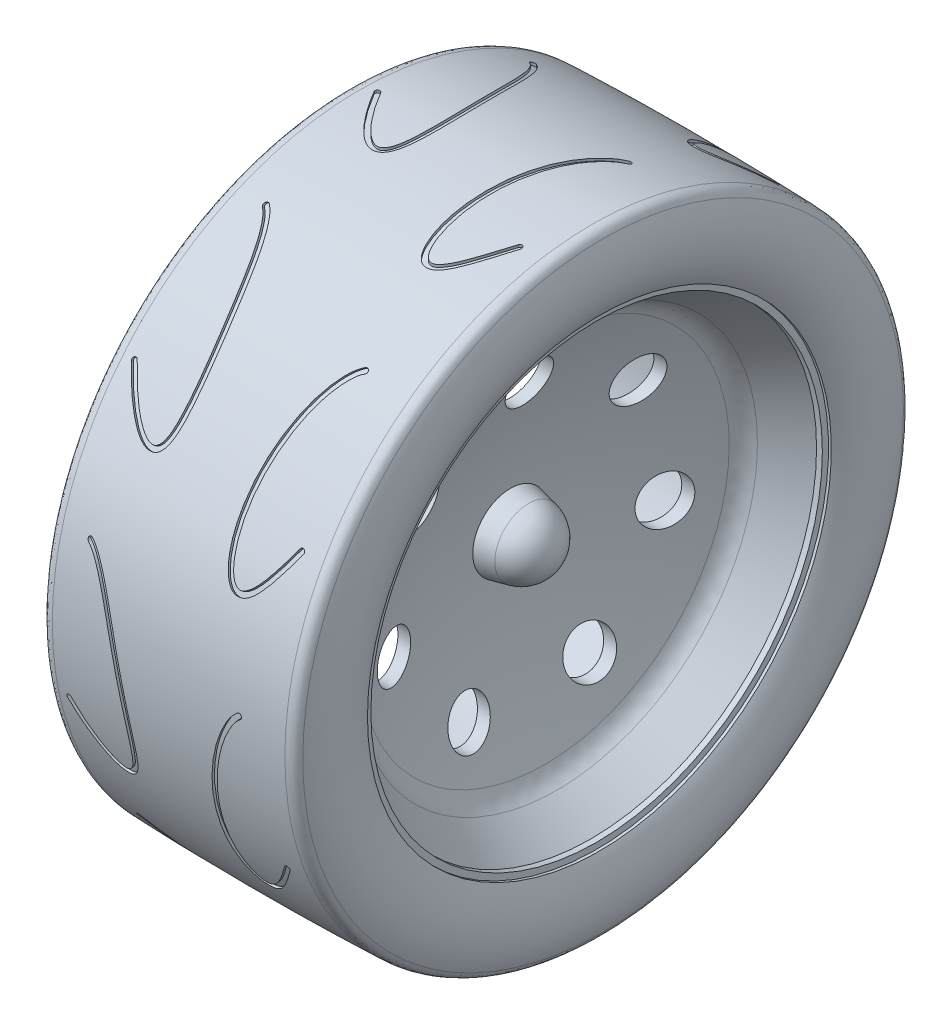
SolidWorks part; units mm, degrees
ref_plane "Front" through (0, 0, 0) normal (0, 0, 1) x (1, 0, 0)
ref_plane "Top" through (0, 0, 0) normal (0, 1, 0) x (1, 0, 0)
ref_plane "Right" through (0, 0, 0) normal (1, 0, 0) x (0, 0, -1)
sketch "Sketch3" plane through (0, 0, 0) normal (0, 0, 1) x (1, 0, 0)
  line L0 (0, 9.934) -> (0, -14.1805) construction
  line L1 (0, 0) -> (3.4314, 0) construction
  line L3 (-2.5342, 4.7625) -> (2.5342, 4.7625)
  arc A0 (-2.5342, 6.3078) -> (2.5342, 6.3078) centre (0, -69.85) cw
  arc A1 (-2.5342, 6.3078) -> (-2.5342, 4.7625) centre (-1.2627, 5.5352) ccw
  arc A2 (2.5342, 6.3078) -> (2.5342, 4.7625) centre (1.2627, 5.5352) cw
  dimension "D1" = 12.7
  dimension "D2" = 76.2
  dimension "D3" = 5.0685
  dimension "D4" = 9.525
revolve "Revolve1" add sketch "Sketch3" angle 360 about L1
sketch "Sketch4" plane through (0, 0, 0) normal (0, 0, 1) x (1, 0, 0)
  line L0 (-4.3412, 0) -> (5.4145, 0) construction
  line L1 (-2.4765, 4.7625) -> (2.4765, 4.7625)
  line L2 (2.5342, 4.7625) -> (-2.5342, 4.7625) construction
  line L3 (0, 5.5228) -> (0, -1.3049) construction
  line L4 (0, -1.3049) -> (0.1262, -1.1271) construction
  line L5 (-2.4765, 4.7625) -> (-2.4765, 4.6355)
  line L6 (-2.4765, 4.6355) -> (2.4765, 4.6355)
  line L7 (2.4765, 4.6355) -> (2.4765, 4.7625)
  dimension "D1" = 0.127
  dimension "D2" = 4.953
revolve "Revolve2" add sketch "Sketch4" angle 360 about L0
sketch "Sketch5" plane through (0, 0, 0) normal (0, 0, 1) x (1, 0, 0)
  line L0 (2.3576, 4.6355) -> (1.4926, 3.9922)
  line L1 (2.4765, 4.6355) -> (-2.4765, 4.6355) construction
  line L3 (0.6754, 0) -> (0.4214, 0)
  line L5 (1.217, 3.9922) -> (2.082, 4.6355)
  line L6 (2.082, 4.6355) -> (2.3576, 4.6355)
  line L7 (-4.0789, 0) -> (5.1302, 0) construction
  arc A0 (1.4926, 3.9922) -> (0.6754, 0) centre (10.8354, 0) ccw
  arc A1 (1.217, 3.9922) -> (0.4214, 0) centre (10.8354, 0) ccw
  dimension "D1" = 10.16
  dimension "D2" = 0.254
  dimension "D3" = 7.9844
revolve "Revolve3" add sketch "Sketch5" angle 360 about L7
fillet "Fillet1" radius 0.762 1 edges at (1.4926, 0, 3.9922)
sketch "Sketch7" plane through (0, 0, 0) normal (0, 0, 1) x (1, 0, 0)
  line L0 (-0.6598, 0) -> (3.2352, 0) construction
  line L1 (0.7047, 0.7717) -> (1.0786, 0.6912)
  line L2 (0.6754, 0) -> (1.6368, 0)
  arc A1 (1.4089, 3.7904) -> (1.4089, -3.7904) centre (10.8354, 0) ccw construction
  arc A2 (1.0786, 0.6912) -> (1.6368, 0) centre (0.9297, 0) cw
  arc A3 (0.7047, 0.7717) -> (0.6754, 0) centre (10.8354, 0) ccw
sketch "Sketch6" plane through (2.4765, 0, 0) normal (1, 0, 0) x (0, 0, -1)
  line L0 (0, 0) -> (0, 2.8535) construction
  circle A0 centre (0, 0) radius 2.8535 construction
  circle A1 centre (0, 2.8535) radius 0.4776
extrude "Extrude1" cut sketch "Sketch6" against normal through all
pattern_circular "CirPattern1" count 7 over 360 about axis through (0, 0, 0) along (1, 0, 0) of "Extrude1"
revolve "Revolve4" add sketch "Sketch7" angle 360 about L0
fillet "Fillet2" radius 0.254 1 edges at (2.5342, 0, 6.3078)
fillet "Fillet3" radius 0.254 1 edges at (-2.5342, 0, 6.3078)
sketch "Sketch8" plane through (0, 0, 0) normal (0, 1, 0) x (1, 0, 0)
  arc A0 (-1.8347, 2.9352) -> (-1.7775, 3.0192) centre (-1.8061, 2.9772) cw
  arc A1 (-2.1191, 0.1655) -> (-2.2061, 0.1131) centre (-2.1626, 0.1393) ccw
  arc A2 (1.4364, 1.7082) -> (1.4959, 1.6258) centre (1.4662, 1.667) cw
  arc A3 (2.0104, -1.0944) -> (1.9201, -1.0478) centre (1.9653, -1.0711) ccw
  spline S0 degree 3 poles (-1.8061, 2.9772) (-0.7793, 2.2784) (-0.2702, -3.0042) (-2.1626, 0.1393) knots 0 0 0 0 1 1 1 1 construction
  spline S1 degree 3 poles (1.4662, 1.667) (0.5392, 0.9968) (0.3253, -4.2512) (1.9653, -1.0711) knots 0 0 0 0 1 1 1 1 construction
  spline S2 degree 1 poles (-1.8347, 2.9352) (-2.1191, 0.1655) knots 0 0 1 1 construction
  spline S3 degree 3 poles (-1.8347, 2.9352) (-1.7673, 2.8894) (-1.6626, 2.7825) (-1.4332, 2.4236) (-1.1967, 1.8042) (-0.9998, 0.93) (-0.917, 0.0872) (-0.9747, -0.5802) (-1.132, -0.8127) (-1.3059, -0.8009) (-1.5175, -0.6612) (-1.7418, -0.4034) (-1.9456, -0.1141) (-2.0645, 0.0748) (-2.1191, 0.1655) knots 0 0 0 0 0.0625 0.125 0.25 0.375 0.5 0.625 0.75 0.8125 0.875 0.9375 0.96875 1 1 1 1
  spline S4 degree 1 poles (-1.7775, 3.0192) (-2.2061, 0.1131) knots 0 0 1 1 construction
  spline S5 degree 3 poles (-1.7775, 3.0192) (-1.7015, 2.9675) (-1.5794, 2.8429) (-1.3406, 2.4661) (-1.0987, 1.8321) (-0.8989, 0.9472) (-0.8167, 0.0876) (-0.8672, -0.5875) (-1.0648, -0.9197) (-1.3562, -0.8975) (-1.5885, -0.7331) (-1.8224, -0.4657) (-2.0304, -0.1701) (-2.1508, 0.0212) (-2.2061, 0.1131) knots 0 0 0 0 0.0625 0.125 0.25 0.375 0.5 0.625 0.75 0.8125 0.875 0.9375 0.96875 1 1 1 1
  spline S6 degree 1 poles (1.4364, 1.7082) (2.0104, -1.0944) knots 0 0 1 1 construction
  spline S7 degree 3 poles (1.4364, 1.7082) (1.3666, 1.6577) (1.2578, 1.5357) (1.0524, 1.1658) (0.8577, 0.5413) (0.7155, -0.3315) (0.6829, -1.1786) (0.7669, -1.8404) (0.971, -2.1606) (1.2526, -2.127) (1.4658, -1.9546) (1.6748, -1.6812) (1.8577, -1.3811) (1.9625, -1.1873) (2.0104, -1.0944) knots 0 0 0 0 0.0625 0.125 0.25 0.375 0.5 0.625 0.75 0.8125 0.875 0.9375 0.96875 1 1 1 1
  spline S8 degree 1 poles (1.4959, 1.6258) (1.9201, -1.0478) knots 0 0 1 1 construction
  spline S9 degree 3 poles (1.4959, 1.6258) (1.4353, 1.582) (1.3446, 1.4802) (1.1474, 1.1291) (0.9573, 0.5195) (0.8171, -0.3429) (0.7833, -1.1734) (0.873, -1.8285) (1.0364, -2.0512) (1.1963, -2.033) (1.3901, -1.8877) (1.5903, -1.6244) (1.7693, -1.3309) (1.8729, -1.1394) (1.9201, -1.0478) knots 0 0 0 0 0.0625 0.125 0.25 0.375 0.5 0.625 0.75 0.8125 0.875 0.9375 0.96875 1 1 1 1
  dimension "D1" = 0.0508
  dimension "D2" = 0.0508
  dimension "D3" = 0.0508
  dimension "D4" = 0.0508
surface "Surface-Extrude1" sketch "Sketch8" parameters "D1"=10
surface "Surface-Offset1" parameters "D1"=0.0508
surface "Surface-Trim1"
other "SurfaceCut1"
other "SurfaceCut2"
pattern_circular "CirPattern2" count 7 over 360 about axis through (0, 0, 0) along (-1, 0, 0) of "SurfaceCut1", "SurfaceCut2"
delete or keep bodies "Body-Delete1" type delete bodies bodies 113 114
